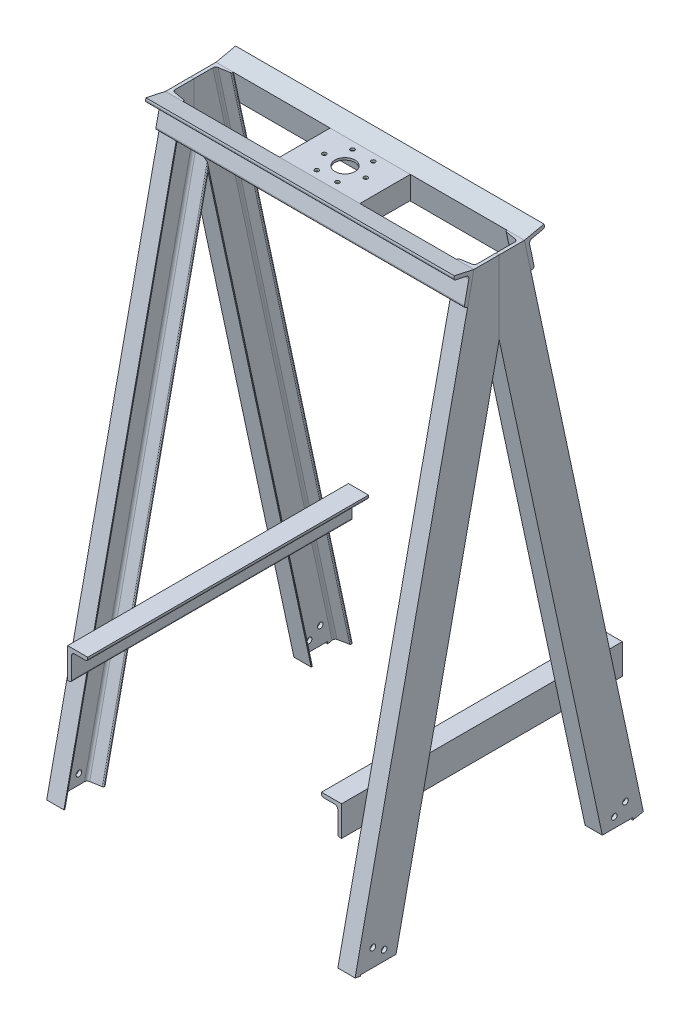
SolidWorks part; units mm, degrees
ref_plane "Front Plane" through (0, 0, 0) normal (0, 0, 1) x (1, 0, 0)
ref_plane "Top Plane" through (0, 0, 0) normal (0, 1, 0) x (1, 0, 0)
ref_plane "Right Plane" through (0, 0, 0) normal (1, 0, 0) x (0, 0, -1)
sketch3d "3DSketch1"
  line L1 (-390.5597, 0, -365.125) -> (-390.5597, 0, 365.125) construction
  line L2 (-390.5597, 0, -365.125) -> (390.5597, 0, -365.125) construction
  line L3 (390.5597, 0, -365.125) -> (390.5597, 0, 365.125) construction
  line L4 (-390.5597, 0, 365.125) -> (390.5597, 0, 365.125) construction
  line L5 (-390.5597, 0, 0) -> (390.5597, 0, 0) construction
  line L6 (390.5597, 0, 365.125) -> (390.5597, 1701.8, 0)
  line L7 (390.5597, 0, -365.125) -> (390.5597, 1701.8, 0)
  line L8 (-390.5597, 0, 365.125) -> (-390.5597, 1701.8, 0)
  line L9 (-390.5597, 0, -365.125) -> (-390.5597, 1701.8, 0)
  line L11 (-390.5631, -7.4096, 390.525) -> (-390.5631, 63.5, 390.525) construction
  line L12 (-390.5597, 1403.7821, -63.9404) -> (390.5597, 1403.7821, -63.9404)
  line L13 (-390.5597, 1403.7821, 63.9404) -> (390.5597, 1403.7821, 63.9404)
  line L14 (-346.8717, 355.6, 355.6) -> (-346.8717, 355.6, -355.6)
  line L15 (346.8717, 355.6, 355.6) -> (346.8717, 355.6, -355.6)
  line L16 (-346.8717, 355.6, 0) -> (346.8717, 355.6, 0) construction
  line L17 (0, 0, 0) -> (0, 0, -365.125) construction
  line L18 (0, 1403.7821, 63.9404) -> (0, 1403.7821, -63.9404)
  line L19 (6.35, 1403.7821, 63.9404) -> (6.35, 1403.7821, -63.9404)
  line L20 (0, 0, 0) -> (0, 355.6, 0) construction
  line L22 (-346.8717, 355.6, 0) -> (-346.8717, 0, 0) construction
  line L23 (-6.35, 1403.7821, 63.9404) -> (-6.35, 1403.7821, -63.9404)
  line L24 (-390.5597, 63.5, -396.875) -> (-390.5597, 63.5, 396.875) construction
  dimension "D2" = 1701.8
  dimension "D9" = 6.35
  dimension "D3" = 355.6
  dimension "D4" = 304.8
  dimension "D5" = 25.4
  dimension "D6" = 43.688
  dimension "D7" = 711.2
  dimension "D8" = 6.35
  dimension "D11" = 24.219
other "Structural Member5"
ref_plane "Plane5" through (390.5597, 0, 365.125) normal (0, 0.9777, -0.2098) x (1, 0, 0)
sketch "Sketch1301" plane through (390.5597, 0, 365.125) normal (0, 0.9777, -0.2098) x (1, 0, 0)
  line L0 (0, 0) -> (0, 101.6)
  line L1 (0, 101.6) -> (43.688, 101.6)
  line L2 (0, 0) -> (43.688, 0)
  line L5 (0, 50.8) -> (8.128, 50.8) construction
  line L12 (8.128, 85.725) -> (8.128, 15.875)
  line L15 (43.688, 101.6) -> (43.688, 100.0436)
  line L16 (43.688, 0) -> (43.688, 1.5564)
  line L17 (14.0707, 92.7402) -> (41.3534, 97.2877)
  line L18 (14.0707, 8.8598) -> (41.3534, 4.3123)
  arc A9 (8.128, 15.875) -> (14.0707, 8.8598) centre (15.24, 15.875) ccw
  arc A10 (8.128, 85.725) -> (14.0707, 92.7402) centre (15.24, 85.725) cw
  arc A11 (43.688, 100.0436) -> (41.3534, 97.2877) centre (40.894, 100.0436) cw
  arc A12 (43.688, 1.5564) -> (41.3534, 4.3123) centre (40.894, 1.5564) ccw
  point P4 (21.844, 101.6)
  point P5 (21.844, 0)
  point P8 (0, 0)
  dimension "RI" = 7.112
  dimension "D2" = 9.463
  dimension "RA" = 2.794
  dimension "DEPTH" = 101.6
  dimension "BF" = 43.688
  dimension "TW" = 8.128
  dimension "d1" = 69.85
other "Structural Member7"
ref_plane "Plane9" through (-390.5597, 1403.7821, 63.9404) normal (1, 0, 0) x (0, 0, -1)
sketch "Sketch128" plane through (-390.5597, 1403.7821, 63.9404) normal (1, 0, 0) x (0, 0, -1)
  line L0 (0, 0) -> (0, 76.2)
  line L1 (0, 76.2) -> (4.7549, 76.2)
  line L2 (9.525, 71.4299) -> (9.525, 17.4752)
  line L3 (17.4752, 9.525) -> (46.0299, 9.525)
  line L4 (50.8, 4.7549) -> (50.8, 0)
  line L5 (50.8, 0) -> (0, 0)
  arc A0 (50.8, 4.7549) -> (46.0299, 9.525) centre (46.0299, 4.7549) ccw
  arc A1 (4.7549, 76.2) -> (9.525, 71.4299) centre (4.7549, 71.4299) cw
  arc A2 (17.4752, 9.525) -> (9.525, 17.4752) centre (17.4752, 17.4752) cw
  circle A3 centre (0, 0) radius 4.7752 construction
  point P10 (0, 38.1)
  point P14 (25.4, 0)
  point P15 (0, 0)
  dimension "D2" = 4.7549
  dimension "Radius_1" = 7.9502
  dimension "Radius_2" = 4.7752
  dimension "D1" = 9.525
  dimension "V_leg" = 76.2
  dimension "H_leg" = 50.8
  dimension "Thickness" = 9.525
  dimension "Flat_wid" = 4.7549
sketch "Sketch16" plane through (0, 0, 0) normal (1, 0, 0) x (0, 0, -1)
  line L0 (-135.866, 1752.6) -> (138.986, 1752.6)
  line L1 (-351.3756, 0) -> (338.698, 0)
  line L2 (-351.3756, 0) -> (-351.3756, -37.1664)
  line L3 (-351.3756, -37.1664) -> (338.698, -37.1664)
  line L4 (338.698, 0) -> (338.698, -37.1664)
  line L5 (-63.9404, 1403.7821) -> (63.9404, 1403.7821)
  line L6 (63.9404, 1403.7821) -> (138.986, 1752.6)
  line L9 (-63.9404, 1403.7821) -> (-135.866, 1752.6)
  dimension "D1" = 50.8
other "Structural Member9"
ref_plane "Plane11" through (-346.8717, 355.6, 355.6) normal (0, 0, -1) x (1, 0, 0)
sketch "Sketch129" plane through (-346.8717, 355.6, 355.6) normal (0, 0, -1) x (1, 0, 0)
  line L0 (0, 0) -> (0, 76.2)
  line L1 (0, 76.2) -> (4.7549, 76.2)
  line L2 (9.525, 71.4299) -> (9.525, 17.4752)
  line L3 (17.4752, 9.525) -> (46.0299, 9.525)
  line L4 (50.8, 4.7549) -> (50.8, 0)
  line L5 (50.8, 0) -> (0, 0)
  arc A0 (50.8, 4.7549) -> (46.0299, 9.525) centre (46.0299, 4.7549) ccw
  arc A1 (4.7549, 76.2) -> (9.525, 71.4299) centre (4.7549, 71.4299) cw
  arc A2 (17.4752, 9.525) -> (9.525, 17.4752) centre (17.4752, 17.4752) cw
  circle A3 centre (0, 0) radius 4.7752 construction
  point P10 (0, 38.1)
  point P14 (25.4, 0)
  point P15 (0, 0)
  dimension "D2" = 4.7549
  dimension "Radius_1" = 7.9502
  dimension "Radius_2" = 4.7752
  dimension "D1" = 9.525
  dimension "V_leg" = 76.2
  dimension "H_leg" = 50.8
  dimension "Thickness" = 9.525
  dimension "Flat_wid" = 4.7549
other "Structural Member12"
ref_plane "Plane14" through (0, 1403.7821, 63.9404) normal (0, 0, -1) x (1, 0, 0)
sketch "Sketch1" plane through (0, 1403.7821, 63.9404) normal (0, 0, -1) x (1, 0, 0)
  line L0 (0, 0) -> (0, 203.2)
  line L1 (0, 203.2) -> (57.404, 203.2)
  line L2 (0, 0) -> (57.404, 0)
  line L5 (57.404, 9.906) -> (0, 9.906) construction
  line L12 (5.588, 182.0903) -> (5.588, 21.1097)
  line L15 (57.404, 203.2) -> (57.404, 200.4095)
  line L16 (57.404, 0) -> (57.404, 2.7905)
  line L17 (12.3797, 190.1077) -> (54.6449, 197.1524)
  line L18 (12.3797, 13.0923) -> (54.6449, 6.0476)
  arc A9 (5.588, 21.1097) -> (12.3797, 13.0923) centre (13.716, 21.1097) ccw
  arc A10 (5.588, 182.0903) -> (12.3797, 190.1077) centre (13.716, 182.0903) cw
  arc A11 (57.404, 200.4095) -> (54.6449, 197.1524) centre (54.102, 200.4095) cw
  arc A12 (57.404, 2.7905) -> (54.6449, 6.0476) centre (54.102, 2.7905) ccw
  point P4 (28.702, 203.2)
  point P5 (5.588, 101.6)
  point P6 (28.702, 0)
  point P7 (0, 101.6)
  point P10 (0, 0)
  dimension "RI" = 8.128
  dimension "D2" = 9.463
  dimension "RA" = 3.302
  dimension "Depth" = 203.2
  dimension "BF" = 57.404
  dimension "TW" = 5.588
  dimension "flange" = 2.7905
  dimension "TF" = 9.906
sketch "Sketch119" plane through (0, 1403.7821, 0) normal (0, 1, 0) x (1, 0, 0)
  circle A0 centre (0, 0) radius 25.4
  dimension "D1" = 50.8
extrude "Extrude2" cut sketch "Sketch119" against normal up to next
extrude "Extrude3" cut sketch "Sketch16" against normal mid plane 1016
hole_wizard "13/32 (0.40625) Diameter Hole1" positions "Sketch123" profile "Sketch124" hole size "13/32" standard "Ansi Inch"
sketch "Sketch123" plane through (0, 1403.7821, 0) normal (0, 1, 0) x (-1, 0, 0)
  circle A0 centre (52.3875, 0) radius 4.9657 construction
  point P0 (52.3875, 0)
sketch "Sketch124" plane through (-52.3875, 1403.7821, 0) normal (1, 0, 0) x (0, 0, 1)
  line L0 (0, 0) -> (0, 5.589)
  line L1 (0, 5.589) -> (5.1594, 5.589)
  line L2 (5.1594, 5.589) -> (5.1594, 0)
  line L5 (5.1594, 0) -> (0, 0)
  line L11 (0, -6.35) -> (0, 107.95) construction
  dimension "Thru Hole Dia." = 10.3187
  dimension "Thru Hole Depth" = 5.589
hole_wizard "9/16 (0.5625) Diameter Hole1" positions "Sketch131" profile "Sketch130" hole size "9/16" standard "Ansi Inch"
sketch "Sketch131" plane through (390.5597, -1025.5345, 16.5203) normal (1, 0, 0) x (0, 0, -1)
  line L1 (381.6453, 1025.5345) -> (-348.6047, 1025.5345) construction
  line L2 (293.9695, 1025.5345) -> (16.5203, 2318.6887) construction
  line L3 (366.1236, 1022.2043) -> (64.2245, 2429.3166) construction
  point P0 (336.3887, 1069.9845)
  point P1 (308.0034, 1050.9345)
  dimension "D1" = 25.4
  dimension "D2" = 19.05
  dimension "D3" = 19.05
  dimension "D4" = 19.05
sketch "Sketch130" plane through (390.5597, 44.45, -319.8684) normal (0, 1, 0) x (0, 0, -1)
  line L0 (0, 0) -> (0, 781.1194)
  line L1 (0, 781.1194) -> (7.1437, 781.1194)
  line L2 (7.1437, 781.1194) -> (7.1437, 0)
  line L5 (7.1437, 0) -> (0, 0)
  line L11 (0, -6.35) -> (0, 107.95) construction
  dimension "Thru Hole Dia." = 14.2875
  dimension "Thru Hole Depth" = 781.1194
pattern_circular "CirPattern1" count 6 over 360 about axis through (0, 0, 0) along (0, 1, 0) of "13/32 (0.40625) Diameter Hole1"
mirror "Mirror1" about plane through (0, 0, 0) normal (0, 0, 1) of "9/16 (0.5625) Diameter Hole1"
